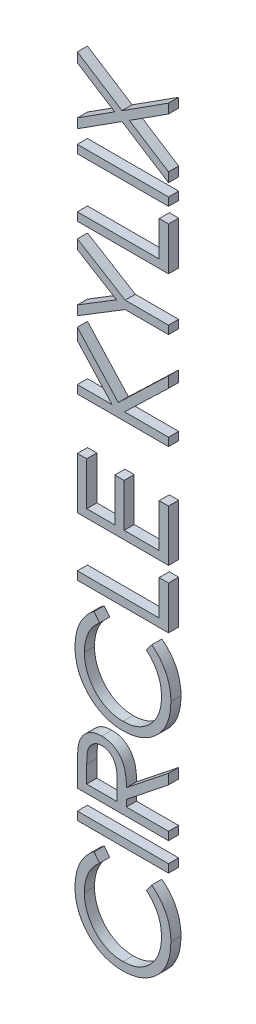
SolidWorks part; units mm, degrees
ref_plane "Piano frontale" through (0, 0, 0) normal (0, 0, 1) x (1, 0, 0)
ref_plane "Piano superiore" through (0, 0, 0) normal (0, 1, 0) x (1, 0, 0)
ref_plane "Piano destro" through (0, 0, 0) normal (1, 0, 0) x (0, 0, -1)
sketch "Schizzo2" plane through (0, 0, 0) normal (0, 0, 1) x (1, 0, 0)
  line L1 (195, 0) -> (195, 1000) construction
  text T0 "CIRCLE KYLIX  " font "Century Gothic" height 90
extrude "Estrusione-Estrusione1" add sketch "Schizzo2" along normal blind 10
